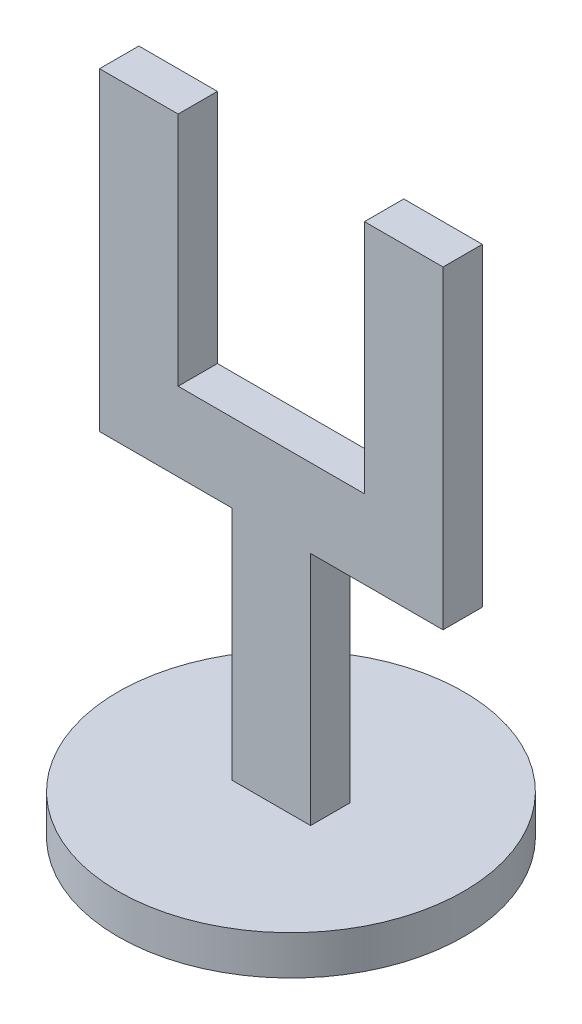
SolidWorks part; units mm, degrees
ref_plane "Front Plane" through (0, 0, 0) normal (0, 0, 1) x (1, 0, 0)
ref_plane "Top Plane" through (0, 0, 0) normal (0, 1, 0) x (1, 0, 0)
ref_plane "Right Plane" through (0, 0, 0) normal (1, 0, 0) x (0, 0, -1)
sketch "Sketch1" plane through (0, 0, 0) normal (0, 1, 0) x (1, 0, 0)
  circle A0 centre (0, 0) radius 22
  dimension "D1" = 44
extrude "Boss-Extrude1" add sketch "Sketch1" along normal blind 5
sketch "Sketch2" plane through (0, 0, 0) normal (0, -1, 0) x (1, 0, 0)
  circle A0 centre (0, 0) radius 20.5
  dimension "D1" = 41
extrude "Cut-Extrude1" cut sketch "Sketch2" against normal blind 2.5
sketch "Sketch3" plane through (0, 5, 0) normal (0, 1, 0) x (1, 0, 0)
  line L1 (-5, 2.5) -> (5, 2.5)
  line L2 (-5, 2.5) -> (-5, -2.5)
  line L3 (-5, -2.5) -> (5, -2.5)
  line L4 (5, 2.5) -> (5, -2.5)
  line L5 (-5, 2.5) -> (5, -2.5) construction
  line L6 (-5, -2.5) -> (5, 2.5) construction
  point P0 (0, 0)
  dimension "D1" = 10
  dimension "D2" = 5
extrude "Boss-Extrude2" add sketch "Sketch3" along normal blind 30
sketch "Sketch4" plane through (0, 35, 0) normal (0, 1, 0) x (1, 0, 0)
  line L0 (5, 2.5) -> (-5, 2.5) construction
  line L1 (21.8575, -2.5) -> (-21.8575, -2.5)
  line L2 (21.8575, -2.5) -> (21.8575, 2.5)
  line L3 (21.8575, 2.5) -> (-21.8575, 2.5)
  line L4 (-21.8575, -2.5) -> (-21.8575, 2.5)
  line L5 (21.8575, -2.5) -> (-21.8575, 2.5) construction
  line L6 (21.8575, 2.5) -> (-21.8575, -2.5) construction
  circle A0 centre (0, 0) radius 22 construction
  point P0 (0, 0)
extrude "Boss-Extrude3" add sketch "Sketch4" along normal blind 10
sketch "Sketch5" plane through (0, 45, 0) normal (0, 1, 0) x (1, 0, 0)
  line L0 (-21.8575, -2.5) -> (21.8575, -2.5) construction
  line L1 (21.8575, 2.5) -> (11.8575, 2.5)
  line L2 (21.8575, 2.5) -> (21.8575, -2.5)
  line L3 (21.8575, -2.5) -> (11.8575, -2.5)
  line L4 (11.8575, 2.5) -> (11.8575, -2.5)
  line L6 (-21.8575, 2.5) -> (-11.8575, 2.5)
  line L7 (-21.8575, 2.5) -> (-21.8575, -2.5)
  line L8 (-21.8575, -2.5) -> (-11.8575, -2.5)
  line L9 (-11.8575, 2.5) -> (-11.8575, -2.5)
  dimension "D1" = 10
extrude "Boss-Extrude4" add sketch "Sketch5" along normal blind 30
